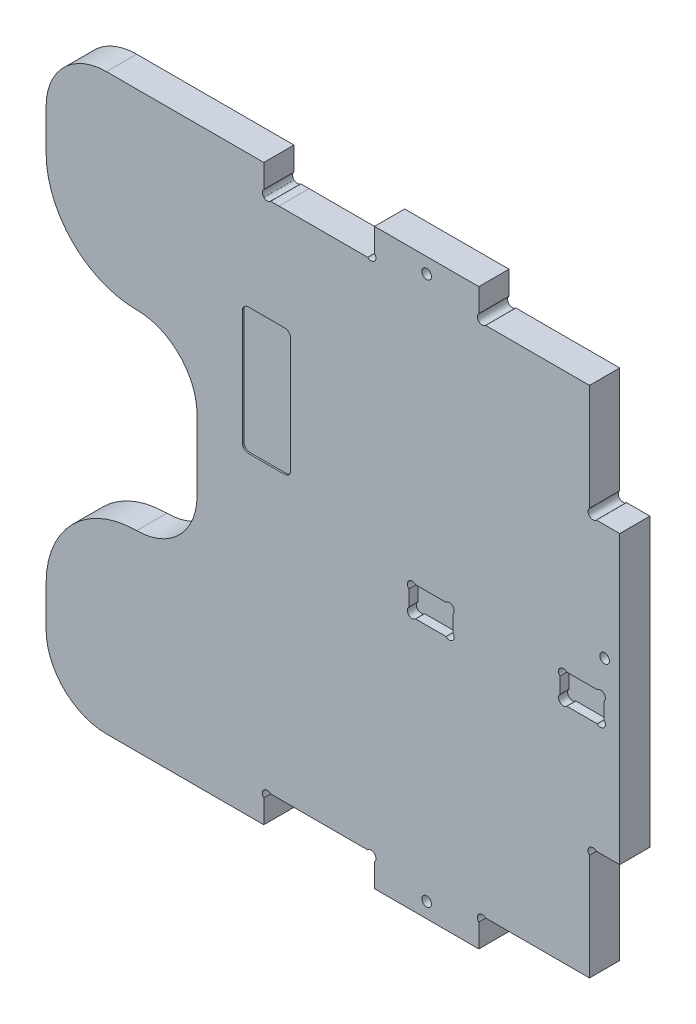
SolidWorks part; units mm, degrees
ref_plane "Plan de face" through (0, 0, 0) normal (0, 0, 1) x (1, 0, 0)
ref_plane "Plan de dessus" through (0, 0, 0) normal (0, 1, 0) x (1, 0, 0)
ref_plane "Plan de droite" through (0, 0, 0) normal (1, 0, 0) x (0, 0, -1)
sketch "Esquisse1" plane through (0, 0, 0) normal (0, 0, 1) x (1, 0, 0)
  line L0 (-20.3837, 95) -> (-20.5726, -95)
  line L1 (-20.3837, 95) -> (97.5, 95)
  line L3 (-20.5726, -95) -> (97.5, -95)
  line L4 (97.5, 95) -> (97.5, -95)
  line L5 (-97.5, 95) -> (97.5, -95) construction
  line L6 (-97.5, -95) -> (97.5, 95) construction
  point P0 (0, 0)
  dimension "D1" = 117.8837
extrude "Boss.-Extru.1" add sketch "Esquisse1" along normal blind 10
sketch "Esquisse3" plane through (0, 0, 10) normal (0, 0, 1) x (1, 0, 0)
  line L0 (97.5, 95) -> (-20.3837, 95) construction
  line L2 (85.005, -0.9) -> (85.005, -10.9) construction
  line L6 (97.5, -95) -> (97.5, 95) construction
  line L16 (0, 95) -> (0, -115.5196) construction
  line L18 (59.9621, -12.7296) -> (59.9622, -39.0058) construction
  line L19 (79.9727, -1) -> (90.0373, -1)
  line L20 (77.71, -3.2627) -> (77.71, -8.5373)
  line L21 (79.9727, -10.8) -> (90.0373, -10.8)
  line L22 (92.3, -3.2627) -> (92.3, -8.5373)
  line L23 (77.71, -5.9) -> (95.0128, -5.9) construction
  line L24 (77.71, -1) -> (80.9659, -4.2559) construction
  line L25 (42.2142, -1.0001) -> (38.9584, -4.256) construction
  line L26 (42.2143, -5.9001) -> (24.9115, -5.9001) construction
  line L27 (34.9192, -0.9001) -> (34.9193, -10.9001) construction
  line L28 (27.6243, -3.2629) -> (27.6243, -8.5374)
  line L29 (39.9515, -10.8001) -> (29.887, -10.8001)
  line L30 (42.2143, -3.2628) -> (42.2143, -8.5373)
  line L31 (39.9515, -1.0001) -> (29.887, -1.0001)
  arc A8 (79.9727, -1) -> (77.71, -3.2627) centre (78.8414, -2.1314) ccw
  arc A9 (79.9727, -10.8) -> (77.71, -8.5373) centre (78.8414, -9.6686) cw
  arc A10 (90.0373, -10.8) -> (92.3, -8.5373) centre (91.1686, -9.6686) ccw
  arc A11 (90.0373, -1) -> (92.3, -3.2627) centre (91.1686, -2.1314) cw
  arc A12 (29.887, -1.0001) -> (27.6243, -3.2629) centre (28.7556, -2.1315) ccw
  arc A13 (29.887, -10.8001) -> (27.6243, -8.5374) centre (28.7557, -9.6688) cw
  arc A14 (39.9515, -10.8001) -> (42.2143, -8.5373) centre (41.0829, -9.6687) ccw
  arc A15 (39.9515, -1.0001) -> (42.2143, -3.2628) centre (41.0829, -2.1314) cw
  point P54 (78.8414, -2.1314)
  dimension "D8" = 96
  dimension "D3" = 5.2
  dimension "D9" = 1.6
extrude "Enlèv. mat.-Extru.2" cut sketch "Esquisse3" against normal blind 3
sketch "Esquisse5" plane through (0, 0, 10) normal (0, 0, 1) x (1, 0, 0)
  line L5 (87.5, 47.5) -> (107.6132, 67.6132) construction
  line L6 (87.5, 95) -> (87.5, 49.7627)
  line L7 (97.5, 47.5) -> (89.7627, 47.5)
  line L8 (97.5, 95) -> (97.5, 47.5)
  line L10 (97.5, 95) -> (87.5, 95)
  line L12 (87.5, -47.5) -> (107.6132, -67.6132) construction
  line L14 (97.5, -95) -> (87.5, -95)
  line L15 (97.5, -95) -> (97.5, -47.5)
  line L16 (97.5, -47.5) -> (89.7627, -47.5)
  line L17 (87.5, -95) -> (87.5, -49.7627)
  arc A1 (89.7627, 47.5) -> (87.5, 49.7627) centre (88.6314, 48.6314) cw
  arc A2 (89.7627, -47.5) -> (87.5, -49.7627) centre (88.6314, -48.6314) ccw
extrude "Enlèv. mat.-Extru.3" cut sketch "Esquisse5" against normal through all
sketch "Esquisse6" plane through (0, 0, 10) normal (0, 0, 1) x (1, 0, 0)
  line L0 (-20.3837, 95) -> (16.279, 95)
  line L1 (68.4702, 104.7202) -> (48.75, 85) construction
  line L2 (-20.3837, 95) -> (-20.3837, 85)
  line L3 (-20.3837, 85) -> (14.0163, 85)
  line L4 (16.279, 95) -> (16.279, 87.2627)
  line L5 (87.5, 95) -> (-20.3837, 95) construction
  line L6 (-108.1795, 0) -> (128.5121, 0) construction
  line L7 (50.8373, 95) -> (50.8373, 87.2627)
  line L8 (87.5, 85) -> (53.1, 85)
  line L9 (87.5, 95) -> (87.5, 85)
  line L10 (87.5, 95) -> (50.8373, 95)
  line L11 (-1.3539, -104.7202) -> (18.3663, -85) construction
  line L12 (33.5581, 95) -> (33.5581, -102.5751) construction
  line L13 (68.4702, -104.7202) -> (48.75, -85) construction
  line L14 (33.5581, -95) -> (33.5581, 102.5751) construction
  line L15 (33.5581, -95) -> (33.5581, 102.5751) construction
  line L16 (16.279, -95) -> (16.279, -87.2627)
  line L17 (87.5, -95) -> (50.8373, -95)
  line L18 (87.5, -95) -> (87.5, -85)
  line L19 (-20.3837, -85) -> (14.0163, -85)
  line L20 (87.5, -85) -> (53.1, -85)
  line L21 (50.8373, -95) -> (50.8373, -87.2627)
  line L22 (-20.3837, -95) -> (-20.3837, -85)
  line L23 (-20.3837, -95) -> (16.279, -95)
  line L24 (-3.1837, 85) -> (-3.1837, 103.5262) construction
  arc A0 (14.0163, 85) -> (16.279, 87.2627) centre (15.1476, 86.1314) ccw
  arc A1 (53.1, 85) -> (50.8373, 87.2627) centre (51.9686, 86.1314) cw
  arc A2 (53.1, -85) -> (50.8373, -87.2627) centre (51.9686, -86.1314) ccw
  arc A3 (14.0163, -85) -> (16.279, -87.2627) centre (15.1476, -86.1314) cw
  dimension "D1" = 34.4
extrude "Enlèv. mat.-Extru.4" cut sketch "Esquisse6" against normal through all
sketch "Esquisse7" plane through (0, 0, 10) normal (0, 0, 1) x (1, 0, 0)
  line L4 (0, 101.0203) -> (0, -104.4181) construction
  line L5 (-107.1625, 0) -> (118.1401, 0) construction
  line L7 (50.8373, 85) -> (16.279, 95) construction
  line L8 (16.279, -85) -> (50.8373, -95) construction
  circle A2 centre (0, 90) radius 1.6
  circle A3 centre (0, -90) radius 1.6
  arc A4 (50.8373, 87.2627) -> (53.1, 85) centre (51.9686, 86.1314) ccw construction
  circle A5 centre (33.5581, 90) radius 1.6
  arc A6 (16.279, -87.2627) -> (14.0163, -85) centre (15.1476, -86.1314) ccw construction
  circle A7 centre (33.5581, -90) radius 1.6
  circle A8 centre (92.5, 9.2032) radius 1.6
extrude "Enlèv. mat.-Extru.5" cut sketch "Esquisse7" against normal through all
sketch "Esquisse8" plane through (-20.4782, 0.0204, 0) normal (-1, 0.001, 0) x (0, 0, 1)
  line L0 (10, 94.9797) -> (10, -95.0204) construction
  line L1 (0, 94.9797) -> (10, 94.9797)
  line L2 (0, 94.9797) -> (0, 84.9797)
  line L3 (0, 84.9797) -> (10, 84.9797)
  line L4 (10, 94.9797) -> (10, 84.9797)
  line L6 (0, -95.0204) -> (10, -95.0204)
  line L7 (0, -95.0204) -> (0, -85.0204)
  line L8 (0, -85.0204) -> (10, -85.0204)
  line L9 (10, -95.0204) -> (10, -85.0204)
  dimension "D1" = 10
  dimension "D2" = 10
extrude "Enlèv. mat.-Extru.6" cut sketch "Esquisse8" against normal blind 5
sketch "Esquisse9" plane through (0, 0, 10) normal (0, 0, 1) x (1, 0, 0)
  line L0 (97.5, -47.5) -> (97.5, 47.5) construction
  line L1 (-92.5, -85.0002) -> (-92.5, -95)
  line L2 (-20.3937, 85) -> (-20.3937, -85.0002)
  line L3 (-92.5, 95) -> (-92.5, 85)
  line L4 (-92.5, 85) -> (-92.5, 31.6667)
  line L5 (-92.5, -31.6667) -> (-92.5, -85.0002)
  line L6 (-92.5, 31.6667) -> (-42.5, 31.6667)
  line L7 (-20.3937, 85) -> (-20.3937, 95)
  line L8 (-20.3937, 95) -> (-92.5, 95)
  line L10 (-92.5, -31.6667) -> (-42.5, -31.6667)
  line L11 (-42.5, 31.6667) -> (-42.5, -31.6667)
  line L12 (-92.5, -95) -> (-20.3937, -95)
  line L13 (-20.3937, -85.0002) -> (-20.3937, -95)
  dimension "D1" = 190
  dimension "D2" = 63.3333
  dimension "D3" = 63.3333
  dimension "D4" = 190
  dimension "D5" = 50
extrude "Boss.-Extru.3" add sketch "Esquisse9" against normal blind 10
sketch "Esquisse10" plane through (0, 0, 10) normal (0, 0, 1) x (1, 0, 0)
  line L0 (-20.3837, -85) -> (-15.1981, -90.1856) construction
  line L1 (14.0163, -85) -> (-20.3837, -85) construction
  line L2 (-20.3937, -95) -> (-20.3937, -85.0002) construction
  line L3 (-18.121, -85) -> (-20.3937, -87.2527)
  line L6 (-20.3937, 87.2527) -> (-18.121, 85)
  arc A0 (-18.121, -85) -> (-20.3937, -87.2527) centre (-19.2524, -86.1314) ccw
  arc A1 (-18.121, 85) -> (-20.3937, 87.2527) centre (-19.2524, 86.1314) cw
  point P5 (-19.2524, -86.1314)
  dimension "D1" = 45
  dimension "D2" = 1.6
extrude "Enlèv. mat.-Extru.7" cut sketch "Esquisse10" against normal through all
fillet "Congé2" radius 30 2 edges at (-92.5, -31.6667, 5) (-92.5, 31.6667, 5)
fillet "Congé3" radius 20 4 edges at (-42.5, -31.6667, 5) (-92.5, -95, 5) (-42.5, 31.6667, 5) (-92.5, 95, 5)
sketch "Esquisse11" plane through (0, 0, 10) normal (0, 0, 1) x (1, 0, 0)
  line L0 (39.9515, -1.0001) -> (29.887, -1.0001) construction
  line L1 (-27.5, 50.9997) -> (-11.5, 50.9997)
  line L2 (-27.5, 50.9997) -> (-27.5, 8.9997)
  line L3 (-27.5, 8.9997) -> (-11.5, 8.9997)
  line L4 (-11.5, 50.9997) -> (-11.5, 8.9997)
  line L5 (-42.5, 11.6667) -> (-42.5, -11.6667) construction
  dimension "D1" = 16
  dimension "D2" = 42
  dimension "D3" = 10
  dimension "D4" = 15
extrude "Enlèv. mat.-Extru.8" cut sketch "Esquisse11" against normal blind 0.5
fillet "Congé4" radius 2 4 edges at (-11.5, 50.9997, 9.75) (-27.5, 50.9997, 9.75) (-27.5, 8.9997, 9.75) (-11.5, 8.9997, 9.75)
